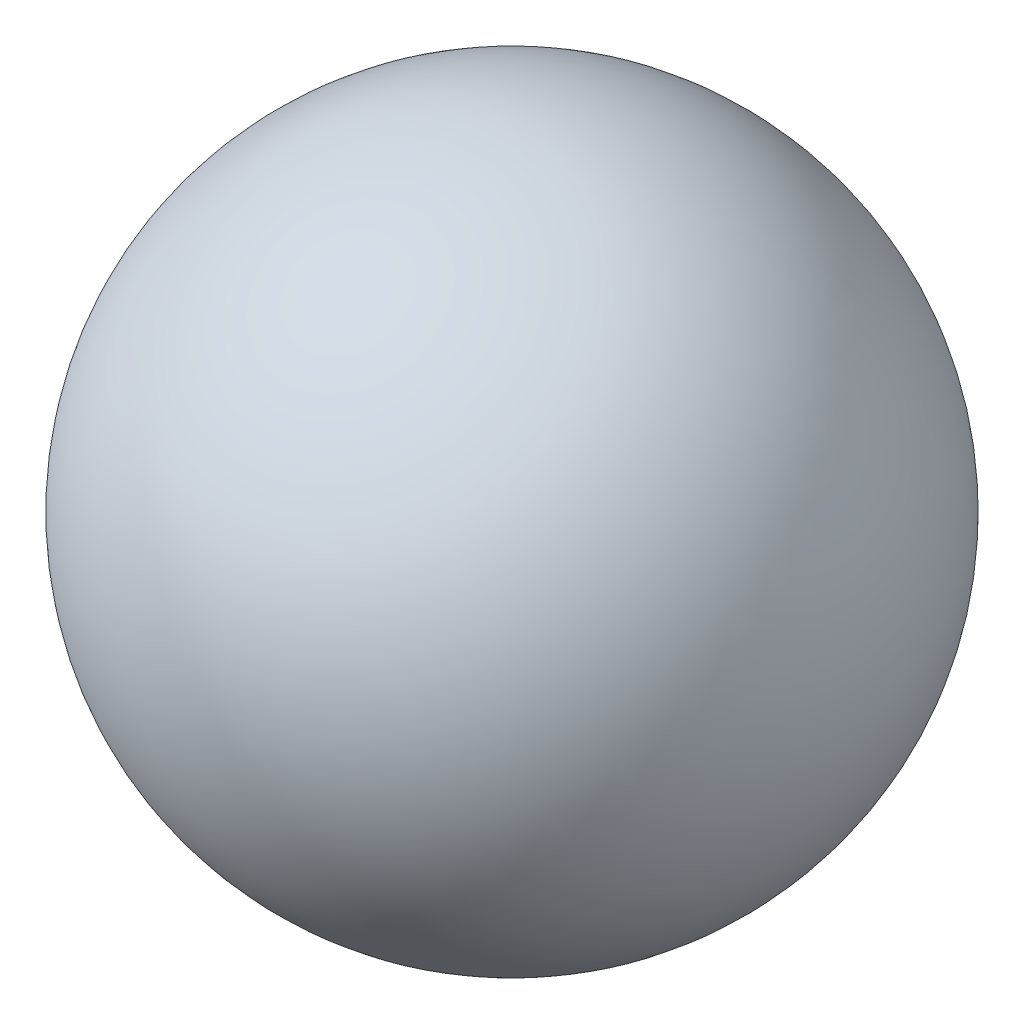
SolidWorks part; units mm, degrees
ref_plane "Plan de face" through (0, 0, 0) normal (0, 0, 1) x (1, 0, 0)
ref_plane "Plan de dessus" through (0, 0, 0) normal (0, 1, 0) x (1, 0, 0)
ref_plane "Plan de droite" through (0, 0, 0) normal (1, 0, 0) x (0, 0, -1)
sketch "Esquisse1" plane through (0, 0, 0) normal (0, 0, 1) x (1, 0, 0)
  line L0 (-0.0696, -1.4984) -> (-0.0696, 1.5016)
  arc A1 (-0.0696, 1.5016) -> (-0.0696, -1.4984) centre (-0.0696, 0.0016) cw
  dimension "D1" = 1.5
revolve "Révolution5" add sketch "Esquisse1" angle 360 about L0
